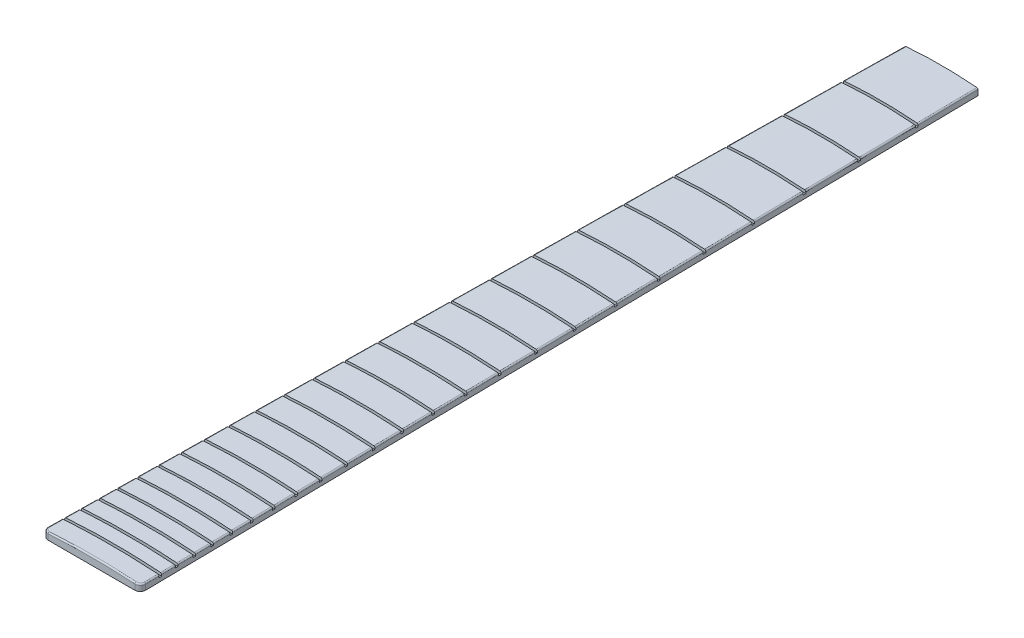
SolidWorks part; units mm, degrees
ref_plane "Front" through (0, 0, 0) normal (0, 0, 1) x (1, 0, 0)
ref_plane "Top" through (0, 0, 0) normal (0, 1, 0) x (1, 0, 0)
ref_plane "Right" through (0, 0, 0) normal (1, 0, 0) x (0, 0, -1)
sketch "Fretboard Layout" plane through (0, 0, 0) normal (0, 1, 0) x (1, 0, 0)
  line L0 (-28.575, -497.84) -> (28.575, -497.84)
  line L1 (0, -647.7) -> (0, 0) construction
  line L2 (-21.4312, 0) -> (21.4312, 0)
  line L3 (-21.4312, 0) -> (-28.575, -497.84)
  line L4 (21.4312, 0) -> (28.575, -497.84)
  line L5 (-39.6411, -650.8198) -> (39.6411, -644.5802) construction
  line L6 (0, -323.85) -> (100.8724, -323.85) construction
  point P11 (0, 0)
  point P12 (0, -497.84)
  dimension "D1" = 647.7
  dimension "D2" = 57.15
  dimension "D3" = 42.8625
  dimension "D4" = 497.84
  dimension "D5" = 4.5
sketch "Sketch6" plane through (0, 0, 0) normal (0, 0, 1) x (1, 0, 0)
  line L0 (21.4312, 0) -> (21.4312, 3.81)
  line L1 (21.4312, 3.81) -> (-21.4312, 3.81) construction
  line L2 (-21.4312, 3.81) -> (-21.4312, 0)
  line L3 (-21.4312, 0) -> (21.4312, 0) construction
  line L4 (21.4312, 0) -> (-21.4312, 0)
  arc A0 (21.4312, 3.81) -> (-21.4312, 3.81) centre (0, -249.2843) ccw
  dimension "D2" = 254
  dimension "D1" = 3.81
ref_plane "Fretboard End Plane" through (0, 0, 497.84) normal (0, 0, 1) x (1, 0, 0)
sketch "Sketch7" plane through (0, 0, 497.84) normal (0, 0, 1) x (1, 0, 0)
  line L0 (-28.575, 0) -> (-28.575, 3.81)
  line L1 (-28.575, 3.81) -> (28.575, 3.81) construction
  line L2 (28.575, 3.81) -> (28.575, 0)
  line L3 (-28.575, 0) -> (28.575, 0)
  arc A0 (-28.575, 3.81) -> (28.575, 3.81) centre (0, -401.5842) cw
  dimension "D2" = 406.4
  dimension "D1" = 3.81
loft "Fretboard- Loft1" add profiles "Sketch6", "Sketch7"
other "Additional Material- Move Face1"
ref_plane "Fret Cut Sketch- Plane2" through (0, 3.81, 0) normal (0, 1, 0) x (1, 0, 0)
fillet "Fillet1" radius 3.175 2 edges
fillet "Round Edges- Fillet1" radius 0.762 5 edges at (27.3407, 3.8945, 497.1417) (-27.8644, 3.8583, 496.609)
sketch "Sketch3" plane through (0, 3.81, 0) normal (0, 1, 0) x (1, 0, 0)
  line L0 (-28.575, 1.524) -> (28.575, 1.524)
  line L1 (20.7095, 1.524) -> (-20.7095, 1.524) construction
  line L3 (28.575, 1.524) -> (28.575, 0)
  line L4 (28.575, 0) -> (-28.575, 0)
  line L5 (-28.575, 0) -> (-28.575, 1.524)
  point P4 (0, 1.524)
  dimension "D1" = 1.524
extrude "Fret Cut- Cut-Extrude1" cut sketch "Sketch3" against normal blind 1.524 and the other way through all
other "Pattern Fret Cuts- TPattern1" parameters "D0"=0, "D1"=36.322, "D2"=0, "D3"=70.612, "D4"=0, "D5"=103.124, "D6"=0, "D7"=133.604, "D8"=0, "D9"=162.56, "D10"=0, "D11"=189.738, "D12"=0, "D13"=215.392, "D14"=0, "D15"=239.776, "D16"=0, "D17"=262.636, "D18"=0, "D19"=284.226, "D20"=0, "D21"=304.546, "D22"=0, "D23"=323.85, "D24"=0, "D25"=342.138, "D26"=0, "D27"=359.156, "D28"=0, "D29"=375.412, "D30"=0, "D31"=390.652, "D32"=0, "D33"=405.13, "D34"=0, "D35"=418.592, "D36"=0, "D37"=431.546, "D38"=0, "D39"=443.738, "D40"=0, "D41"=455.168, "D42"=0, "D43"=465.836, "D44"=0, "D45"=476.25, "D46"=0, "D47"=485.902
other "Remove Fret Cut- DeleteFace2"
other "Remove Material- Move Face2"
equation "\"Scale Length\"= 25.5"
equation "\"D1@Sketch7\"=\"D1@Sketch6\""
